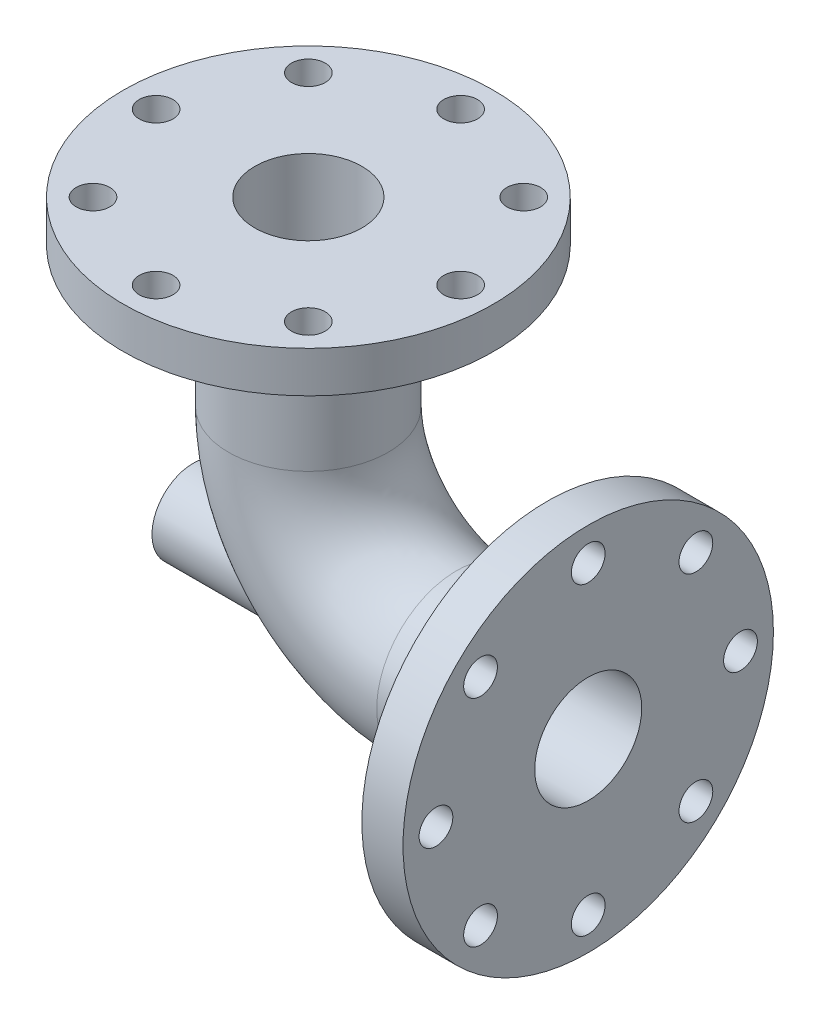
SolidWorks part; units mm, degrees
ref_plane "Front Plane" through (0, 0, 0) normal (0, 0, 1) x (1, 0, 0)
ref_plane "Top Plane" through (0, 0, 0) normal (0, 1, 0) x (1, 0, 0)
ref_plane "Right Plane" through (0, 0, 0) normal (1, 0, 0) x (0, 0, -1)
sketch "Sketch1" plane through (0, 0, 0) normal (0, 0, 1) x (1, 0, 0)
  line L0 (-90, 0) -> (-90, 85)
  line L1 (0, -90) -> (55, -90)
  arc A0 (-90, 0) -> (0, -90) centre (0, 0) ccw
  dimension "D1" = 90
  dimension "D2" = 175
  dimension "D3" = 145
ref_plane "Plane1" through (55, -90, 0) normal (1, 0, 0) x (0, 0, -1)
sketch "Sketch2" plane through (55, -90, 0) normal (1, 0, 0) x (0, 0, -1)
  circle A0 centre (0, 0) radius 48.5
  dimension "D1" = 97
sweep "Sweep-Thin1" add profiles "Sketch2" path "Sketch1" parameters "D1"=16
sketch "Sketch3" plane through (0, 85, 0) normal (0, 1, 0) x (1, 0, 0)
  circle A0 centre (-90, 0) radius 112.5
  circle A1 centre (-90, 0) radius 32.5 construction
  circle A2 centre (-90, 0) radius 32.5
  dimension "D1" = 225
extrude "Boss-Extrude1" add sketch "Sketch3" along normal blind 25
sketch "Sketch4" plane through (55, 0, 0) normal (1, 0, 0) x (0, 0, -1)
  circle A0 centre (0, -90) radius 112.5
  circle A1 centre (0, -90) radius 32.5 construction
  circle A2 centre (0, -90) radius 32.5
  dimension "D1" = 225
extrude "Boss-Extrude2" add sketch "Sketch4" along normal blind 25
other "Hole1"
sketch "Sketch5" plane through (0, 110, 0) normal (0, 1, 0) x (-1, 0, 0)
  circle A0 centre (-2.5, 0) radius 10.25
  dimension "D1" = 20.5
  dimension "D2" = 92.5
pattern_circular "CirPattern1" count 8 over 360 about axis through (-90, 0, 0) along (0, 1, 0) of "Hole1"
other "Hole2" parameters "D1"=25
sketch "Sketch6" plane through (80, 0, 0) normal (1, 0, 0) x (0, 0, -1)
  circle A0 centre (0, 2.5) radius 10.25
  dimension "D1" = 20.5
  dimension "D2" = 92.5
pattern_circular "CirPattern2" count 8 over 360 about axis through (0, -90, 0) along (1, 0, 0) of "Hole2"
ref_plane "Plane2" through (-160, 0, 0) normal (1, 0, 0) x (0, 0, -1)
sketch "Sketch7" plane through (-160, 0, 0) normal (1, 0, 0) x (0, 0, -1)
  circle A0 centre (0, -90) radius 25
  circle A1 centre (0, -90) radius 112.5 construction
  dimension "D1" = 50
extrude "Boss-Extrude3" add sketch "Sketch7" along normal up to next
hole_wizard "CBORE for M16 SBHCS1" positions "Sketch9" profile "Sketch8" counterbore size "M16" standard "Ansi Metric"
sketch "Sketch9" plane through (-160, 0, 0) normal (-1, 0, 0) x (0, 0, 1)
  circle A0 centre (0, -90) radius 25 construction
  point P0 (0, -90)
sketch "Sketch8" plane through (-160, -90, 0) normal (0, 1, 0) x (0, 0, 1)
  line L0 (0, 0) -> (0, 240)
  line L1 (0, 240) -> (10, 240)
  line L3 (10, 240) -> (10, 28)
  line L4 (10, 28) -> (12, 28)
  line L5 (12, 28) -> (12, 0)
  line L7 (12, 0) -> (0, 0)
  line L11 (0, -6.35) -> (0, 107.95) construction
  dimension "Thru Hole Dia." = 20
  dimension "Thru Hole Depth" = 240
  dimension "C'Bore Dia." = 24
  dimension "C'Bore Depth" = 28
